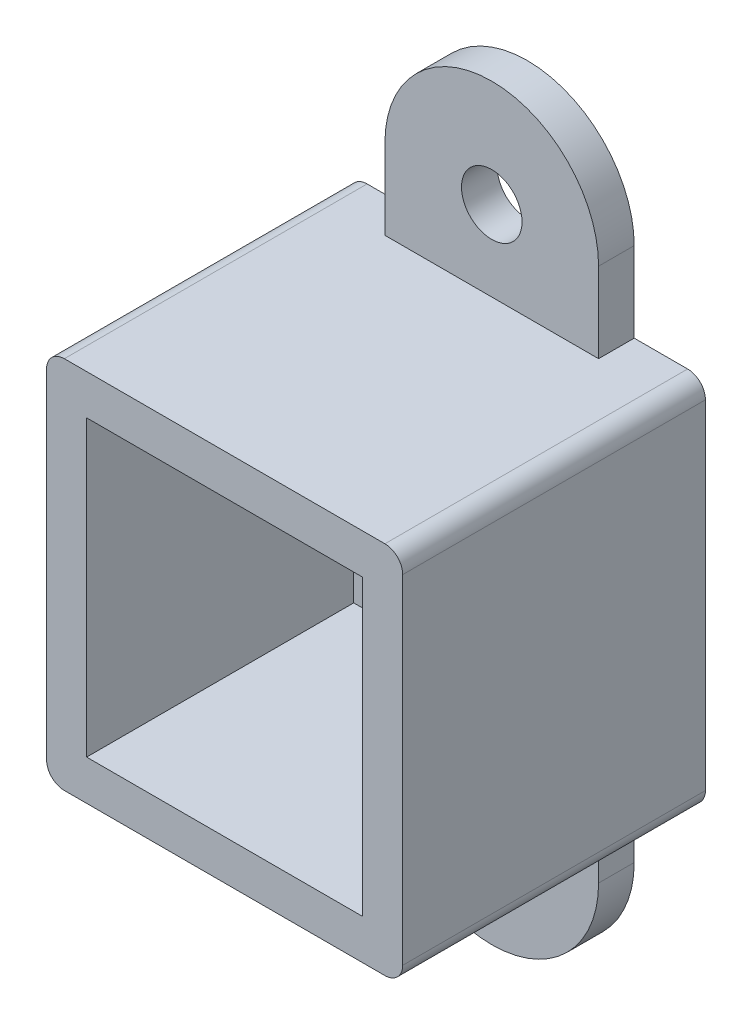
SolidWorks part; units mm, degrees
ref_plane "Front Plane" through (0, 0, 0) normal (0, 0, 1) x (1, 0, 0)
ref_plane "Top Plane" through (0, 0, 0) normal (0, 1, 0) x (1, 0, 0)
ref_plane "Right Plane" through (0, 0, 0) normal (1, 0, 0) x (0, 0, -1)
sketch "Sketch1" plane through (0, 0, 0) normal (0, 0, 1) x (1, 0, 0)
  line L1 (-7.75, -8.25) -> (7.75, -8.25)
  line L2 (-7.75, -8.25) -> (-7.75, 8.25)
  line L3 (-7.75, 8.25) -> (7.75, 8.25)
  line L4 (7.75, -8.25) -> (7.75, 8.25)
  line L5 (-7.75, -8.25) -> (7.75, 8.25) construction
  line L6 (-7.75, 8.25) -> (7.75, -8.25) construction
  line L7 (-10, -10.5) -> (10, -10.5)
  line L8 (-10, -10.5) -> (-10, 10.5)
  line L9 (-10, 10.5) -> (10, 10.5)
  line L10 (10, -10.5) -> (10, 10.5)
  line L11 (-10, -10.5) -> (10, 10.5) construction
  line L12 (-10, 10.5) -> (10, -10.5) construction
  point P0 (0, 0)
  point P6 (0, 0)
  dimension "D1" = 15.5
  dimension "D2" = 16.5
  dimension "D3" = 21
  dimension "D4" = 20
extrude "Boss-Extrude2" add sketch "Sketch1" along normal blind 17
sketch "Sketch2" plane through (0, 0, 0) normal (0, 0, -1) x (-1, 0, 0)
  line L0 (-6, 10.5) -> (-6, 15)
  line L1 (-10, -10.5) -> (-6, -10.5)
  line L2 (-10, -10.5) -> (-10, 10.5)
  line L3 (-10, 10.5) -> (-6, 10.5)
  line L4 (10, -10.5) -> (10, 10.5)
  line L5 (-10, -10.5) -> (10, 10.5) construction
  line L6 (-10, 10.5) -> (10, -10.5) construction
  line L7 (0, -15) -> (0, 15) construction
  line L8 (-6, -15) -> (-6, -10.5)
  line L9 (6, -15) -> (6, -10.5)
  line L10 (6, -10.5) -> (10, -10.5)
  line L11 (6, 10.5) -> (10, 10.5)
  line L12 (6, 10.5) -> (6, 15)
  arc A0 (-6, -15) -> (6, -15) centre (0, -15) ccw
  arc A1 (6, 15) -> (-6, 15) centre (0, 15) ccw
  point P0 (0, 0)
  point P11 (0, 0)
  dimension "D3" = 6
  dimension "D1" = 15
  dimension "D2" = 30
extrude "Boss-Extrude3" add sketch "Sketch2" against normal blind 2
hole_wizard "M3 Clearance Hole1" positions "Sketch4" profile "Sketch3" hole size "M3" standard "ANSI Metric"
sketch "Sketch4" plane through (0, 0, 2) normal (0, 0, 1) x (1, 0, 0)
  line L0 (0, 21) -> (0, -21) construction
  arc A0 (6, 15) -> (-6, 15) centre (0, 15) ccw construction
  arc A1 (-6, -15) -> (6, -15) centre (0, -15) ccw construction
  point P0 (0, 15)
  point P2 (0, -15)
  dimension "D1" = 15
  dimension "D2" = 15
sketch "Sketch3" plane through (0, 15, 2) normal (1, 0, 0) x (0, -1, 0)
  line L0 (0, 0) -> (0, 2)
  line L1 (0, 2) -> (1.7, 2)
  line L2 (1.7, 2) -> (1.7, 0)
  line L5 (1.7, 0) -> (0, 0)
  line L11 (0, -6.35) -> (0, 107.95) construction
  dimension "Thru Hole Dia." = 3.4
  dimension "Thru Hole Depth" = 2
fillet "Fillet1" radius 1 4 edges at (10, 10.5, 8.5) (10, -10.5, 8.5) (-10, -10.5, 8.5) (-10, 10.5, 8.5)
